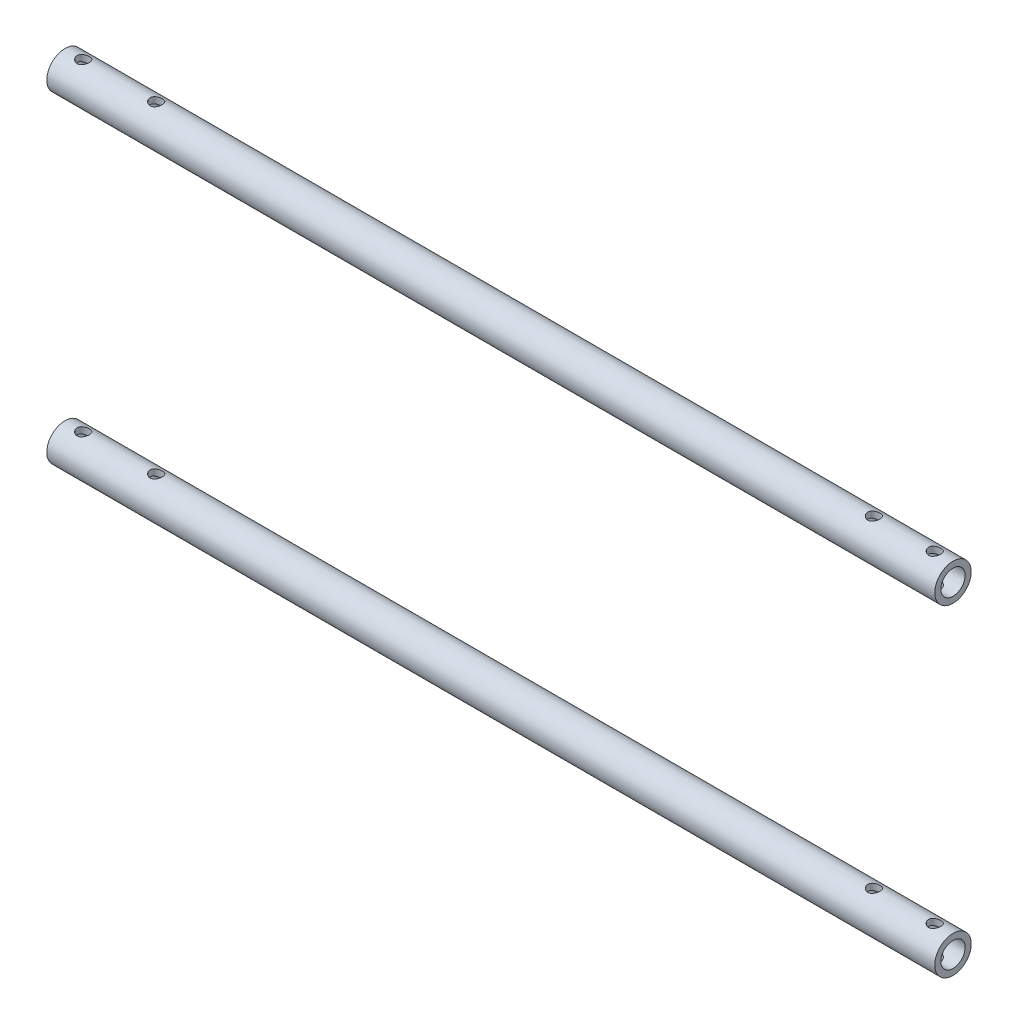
SolidWorks part; units mm, degrees
ref_plane "Front Plane" through (0, 0, 0) normal (0, 0, 1) x (1, 0, 0)
ref_plane "Top Plane" through (0, 0, 0) normal (0, 1, 0) x (1, 0, 0)
ref_plane "Right Plane" through (0, 0, 0) normal (1, 0, 0) x (0, 0, -1)
sketch "Sketch1" plane through (0, 0, 0) normal (0, 0, 1) x (1, 0, 0)
  line L0 (0, 0) -> (463.55, 0) construction
  line L1 (0, 84.1375) -> (463.55, 84.1375) construction
  line L2 (0, -84.1375) -> (463.55, -84.1375) construction
  line L3 (0, 93.6625) -> (463.55, 93.6625)
  line L4 (0, -93.6625) -> (463.55, -93.6625)
  line L5 (9.525, 84.1375) -> (9.525, 87.3125)
  line L6 (47.625, 84.1375) -> (47.625, 87.3125)
  line L7 (422.275, 84.1375) -> (422.275, 0)
  line L8 (454.025, 84.1375) -> (454.025, 0)
  line L11 (422.275, 84.1375) -> (422.275, 87.3125)
  line L12 (454.025, 84.1375) -> (454.025, 87.3125)
  line L13 (9.525, 84.1375) -> (9.525, 0)
  line L14 (47.625, 84.1375) -> (47.625, 0)
  circle A0 centre (454.025, 84.1375) radius 3.175
  circle A1 centre (422.275, 84.1375) radius 3.175
  circle A2 centre (9.525, 84.1375) radius 3.175
  circle A3 centre (47.625, 84.1375) radius 3.175
  circle A4 centre (9.525, -84.1375) radius 3.175
  circle A5 centre (47.625, -84.1375) radius 3.175
  circle A6 centre (422.275, -84.1375) radius 3.175
  circle A7 centre (454.025, -84.1375) radius 3.175
  dimension "D4" = 6.35
  dimension "D1" = 168.275
  dimension "D2" = 19.05
  dimension "D3" = 463.55
  dimension "D5" = 9.525
  dimension "D6" = 31.75
  dimension "D7" = 9.525
  dimension "D8" = 38.1
sketch "Sketch2" plane through (0, 0, 0) normal (0, 0, 1) x (1, 0, 0)
  line L2 (0, 84.1375) -> (463.55, 84.1375) construction
  line L3 (0, 93.6625) -> (463.55, 93.6625) construction
  line L6 (0, 84.1375) -> (463.55, 84.1375) construction
  line L7 (0, 93.6625) -> (463.55, 93.6625)
revolve "Revolve-Thin1" add sketch "Sketch2" angle 360 about L6
sketch "Sketch3" plane through (0, 0, 0) normal (0, 0, 1) x (1, 0, 0)
  line L0 (0, -84.1375) -> (463.55, -84.1375) construction
  line L1 (0, -93.6625) -> (463.55, -93.6625) construction
  line L2 (0, -84.1375) -> (463.55, -84.1375) construction
  line L3 (0, -93.6625) -> (463.55, -93.6625)
revolve "Revolve-Thin2" add sketch "Sketch3" angle 360 about L2
sketch "Sketch6" plane through (0, 0, 0) normal (0, 1, 0) x (1, 0, 0)
  circle A0 centre (9.525, 0) radius 3.175
  circle A1 centre (47.625, 0) radius 3.175
  circle A2 centre (422.275, 0) radius 3.175
  circle A3 centre (454.025, 0) radius 3.175
  dimension "D1" = 6.35
extrude "Cut-Extrude2" cut sketch "Sketch6" against normal mid plane 203.2
